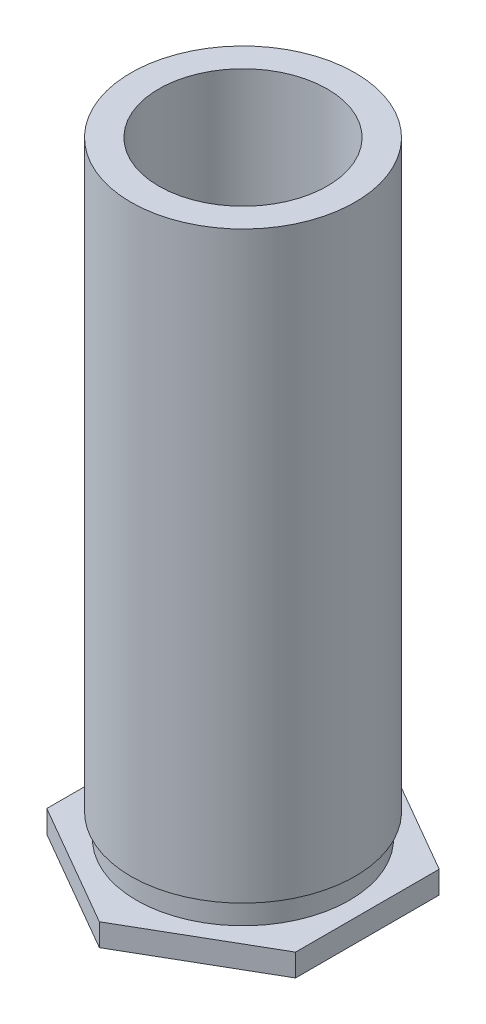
SolidWorks part; units mm, degrees
ref_plane "Plane1" through (0, 0, 0) normal (0, 0, 1) x (1, 0, 0)
ref_plane "Plane2" through (0, 0, 0) normal (0, 1, 0) x (1, 0, 0)
ref_plane "Plane3" through (0, 0, 0) normal (1, 0, 0) x (0, 0, -1)
sketch "BodySke" plane through (0, 0, 0) normal (0, 0, 1) x (1, 0, 0)
  line L0 (3.56, 0) -> (4.582, 0)
  line L1 (4.582, 0) -> (4.582, 0.712)
  line L2 (4.582, 0.712) -> (3.382, 0.712)
  line L3 (2.1, 20) -> (2.1, 0.006)
  line L4 (3.56, 1.4596) -> (3.382, 1.4596)
  line L5 (3.382, 1.4596) -> (3.382, 0.712)
  line L6 (3.56, 0.0025) -> (3.56, 0)
  line L7 (1.016, 19.2) -> (3.6522, 19.2) construction
  line L8 (3.56, 20) -> (2.1, 20)
  line L9 (0, 0) -> (0, 15.24) construction
  line L10 (3.56, 0.0025) -> (0, 0.0025)
  line L11 (3.56, 20) -> (3.56, 1.4596)
  line L12 (0, 0.006) -> (2.1, 0.006)
  line L13 (0, 0.006) -> (0, 0.0025)
  line L14 (1.016, 0.006) -> (3.6522, 0.006) construction
  line L15 (1.016, 0) -> (3.6522, 0) construction
  dimension "D1" = 0.0025
  dimension "E_dia" = 9.164
  dimension "C_dia" = 7.12
  dimension "Thread_min" = 4.2
  dimension "Clinching_ht" = 0.712
  dimension "Advance" = 0.8
  dimension "Length" = 20
  dimension "Thread_limit" = 19.994
  dimension "Thread_depth" = 19.994
  dimension "Drill_depth" = 20
  dimension "Groove_wid" = 0.7476
  dimension "Groove_dia" = 6.764
revolve "Body" add sketch "BodySke"
revolve "EndChamfer" cut sketch "EndChamferSke" angle 360 about L0
sketch "EndChamferSke" plane through (0, 0, 0) normal (0, 0, 1) x (1, 0, 0)
  line L0 (0, -2.54) -> (0, 7.62) construction
  line L1 (0, 0) -> (0, 15.24) construction
  line L2 (2.675, 12) -> (2.675, 20.254)
  line L4 (2.675, 12) -> (2.5, 12)
  line L6 (2.5, 12) -> (2.1, 11.72)
  line L8 (2.1, 11.72) -> (2.1, 20.254)
  line L9 (2.675, 20.254) -> (2.1, 20.254)
  line L10 (3.56, 20) -> (-3.56, 20) construction
  dimension "D1" = 0.254
  dimension "Thread_nominal" = 5
  dimension "D2" = 34.99
  dimension "Thread_min" = 4.2
  dimension "Inset" = 8
  dimension "B_dia" = 5.35
revolve "TapDrill" cut sketch "TapDriSke" angle 360 about L0
sketch "TapDriSke" plane through (0, 0, 0) normal (0, 0, 1) x (1, 0, 0)
  line L0 (0, 0) -> (0, 15.24) construction
  line L1 (0, 0) -> (0, 15.24) construction
  line L2 (2.1, -3.994) -> (2.1, 20)
  line L3 (3.56, 20) -> (-3.56, 20) construction
  line L4 (2.1, -3.994) -> (0, -4.8638)
  line L5 (0, -4.8638) -> (0, 20)
  line L6 (0, 20) -> (2.1, 20)
  line L7 (2.1, 0.006) -> (2.1, 20) construction
  line L8 (0, -4.8638) -> (-2.1, -3.994) construction
  line L9 (-2.1, 20) -> (-2.1, 0.006) construction
  dimension "D1" = 135
  dimension "Depth" = 23.994
ref_plane "Plane4" through (0, -0.5486, 0) normal (0, 1, 0) x (-1, 0, 0)
sketch "ThdSchSke" plane through (0, 0, 0) normal (0, 0, 1) x (1, 0, 0)
  line L0 (0, -5.08) -> (0, 7.62) construction
  line L1 (0, 0) -> (0, 15.24) construction
  line L2 (0, 12) -> (2.5, 12) construction
  line L4 (2.5, 12) -> (2.1, 12.2801)
  line L5 (2.675, 12) -> (-2.675, 12) construction
  line L6 (2.5, 12) -> (2.1, 11.7199)
  line L7 (2.1, 12.2801) -> (2.1, 11.7199)
  dimension "Vee_angle" = 70
  dimension "Thread_nominal" = 5
  dimension "Thread_min" = 4.2
revolve "ThreadSchematic" cut sketch "ThdSchSke" angle 360 about L0
pattern_linear "ThdSchPat" count 16 spacing 0.7996 along (0, -1, 0) of "ThreadSchematic"
sketch "HexDieSke" plane through (0, 0.712, 0) normal (0, 1, 0) x (-1, 0, 0)
  line L0 (0, 4.5611) -> (3.95, 2.2805)
  line L1 (3.95, 2.2805) -> (3.95, -2.2805)
  line L2 (3.95, -2.2805) -> (0, -4.5611)
  line L3 (0, -4.5611) -> (-3.95, -2.2805)
  line L4 (-3.95, -2.2805) -> (-3.95, 2.2805)
  line L5 (-3.95, 2.2805) -> (0, 4.5611)
  circle A1 centre (0, 0) radius 3.95 construction
  circle A2 centre (0, 0) radius 4.5611 construction
  circle A3 centre (0, 0) radius 4.5825
  dimension "Width_across_flats" = 7.9
  dimension "OD" = 9.165
extrude "HexDie" cut sketch "HexDieSke" against normal blind 0.712
equation "' \"Length@BodySke\" = 20"
equation "' \"B_dia@EndChamferSke\" = 5.35"
equation "' \"C_dia@BodySke\" = 7.12"
equation "' \"Width_across_flats@HexDieSke\" = 7.9"
equation "' \"Inset@EndChamferSke\" = 8"
equation "' \"Advance@BodySke\" = 0.8"
equation "' \"Thread_min@BodySke\" = 4.2"
equation "' \"Thread_nominal@ThreadCosmetic\" = 5"
equation "\"E_dia@BodySke\" = \"Width_across_flats@HexDieSke\" * 1.16"
equation "\"Drill_depth@BodySke\" = \"Length@BodySke\""
equation "\"Thread_depth@BodySke\" = \"Length@BodySke\" - 0.006"
equation "\"Clinching_ht@BodySke\" = \"C_dia@BodySke\" * 0.1"
equation "\"Groove_dia@BodySke\" = \"C_dia@BodySke\" * 0.95"
equation "\"Groove_wid@BodySke\" = \"Clinching_ht@BodySke\" * 1.05"
equation "\"Thread_limit@BodySke\" = ((sgn( \"Length@BodySke\" - \"Thread_depth@BodySke\" )-1)*( \"Length@BodySke\" - \"Thread_depth@BodySke\" ))/-2+ \"Thread_depth@BodySke\""
equation "\"Depth@TapDriSke\" = \"Thread_limit@BodySke\" + \"Advance@BodySke\" * 5"
equation "\"Depth@TapDriSke\" = ((sgn( \"Depth@TapDriSke\" - \"Drill_depth@BodySke\" )+1)*( \"Depth@TapDriSke\" - \"Drill_depth@BodySke\" ))/2 +\"Drill_depth@BodySke\""
equation "\"Depth@HexDie\" = \"Clinching_ht@BodySke\""
equation "\"OD@HexDieSke\" =  \"Width_across_flats@HexDieSke\" * 1.16 + 0.001"
equation "\"Thread_nominal@EndChamferSke\" = \"Thread_nominal@ThreadCosmetic\""
equation "\"Thread_min@EndChamferSke\" = \"Thread_min@BodySke\""
equation "\"D2@EndChamferSke\" = \"Vee_angle@ThdSchSke\" / 2 - 0.01"
equation "\"Thread_nominal@ThdSchSke\" = \"Thread_nominal@ThreadCosmetic\""
equation "\"Thread_min@ThdSchSke\" = \"Thread_min@BodySke\""
equation "\"Num_threads@ThdSchPat\" = int(  ( \"Thread_limit@BodySke\" - \"Inset@EndChamferSke\" ) / \"Advance@BodySke\" + 0.999 )  + 1"
equation "\"Advance@ThdSchPat\" = (  \"Thread_limit@BodySke\" - \"Inset@EndChamferSke\" ) /  (\"Num_threads@ThdSchPat\" - 1) 'relax it"
